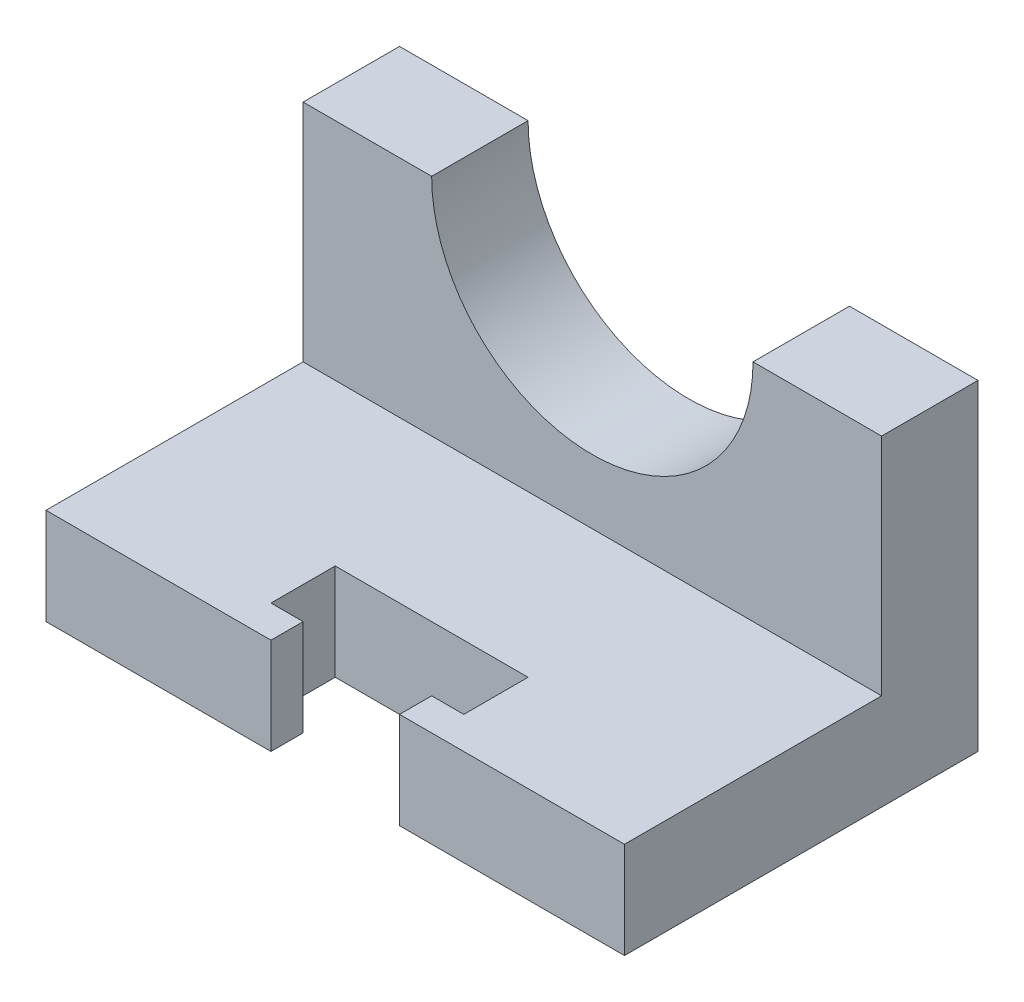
SolidWorks part; units mm, degrees
ref_plane "前视基准面" through (0, 0, 0) normal (0, 0, 1) x (1, 0, 0)
ref_plane "上视基准面" through (0, 0, 0) normal (0, 1, 0) x (1, 0, 0)
ref_plane "右视基准面" through (0, 0, 0) normal (1, 0, 0) x (0, 0, -1)
sketch "草图2" plane through (0, 0, 0) normal (0, 1, 0) x (1, 0, 0)
  line L1 (0, 0) -> (90, 0)
  line L2 (0, 0) -> (0, 55)
  line L3 (0, 55) -> (90, 55)
  line L4 (90, 0) -> (90, 55)
  dimension "D1" = 90
  dimension "D2" = 55
extrude "拉伸1" add sketch "草图2" along normal blind 50
sketch "草图3" plane through (90, 0, 0) normal (1, 0, 0) x (0, 0, -1)
  line L0 (40, 50) -> (40, 15)
  line L1 (0, 50) -> (55, 50) construction
  line L2 (40, 15) -> (0, 15)
  line L3 (0, 50) -> (0, 0) construction
  line L4 (0, 15) -> (0, 50)
  line L5 (0, 50) -> (40, 50)
  dimension "D1" = 40
  dimension "D2" = 35
extrude "切除-拉伸1" cut sketch "草图3" against normal through all
sketch "草图4" plane through (0, 0, -40) normal (0, 0, 1) x (1, 0, 0)
  line L0 (0, 50) -> (90, 50) construction
  circle A0 centre (45, 50) radius 25
  dimension "D1" = 50
extrude "切除-拉伸2" cut sketch "草图4" against normal through all
sketch "草图5" plane through (0, 15, 0) normal (0, 1, 0) x (1, 0, 0)
  line L0 (45, 0) -> (45, 21.3218) construction
  line L1 (0, 0) -> (90, 0) construction
  line L2 (55, 0) -> (35, 0)
  line L3 (35, 0) -> (35, 5)
  line L4 (35, 5) -> (30, 5)
  line L5 (30, 5) -> (30, 15)
  line L6 (30, 15) -> (60, 15)
  line L7 (60, 5) -> (60, 15)
  line L8 (55, 5) -> (60, 5)
  line L9 (55, 0) -> (55, 5)
  point P10 (45, 15)
  dimension "D1" = 10
  dimension "D2" = 15
  dimension "D3" = 10
  dimension "D4" = 5
extrude "切除-拉伸3" cut sketch "草图5" against normal through all
